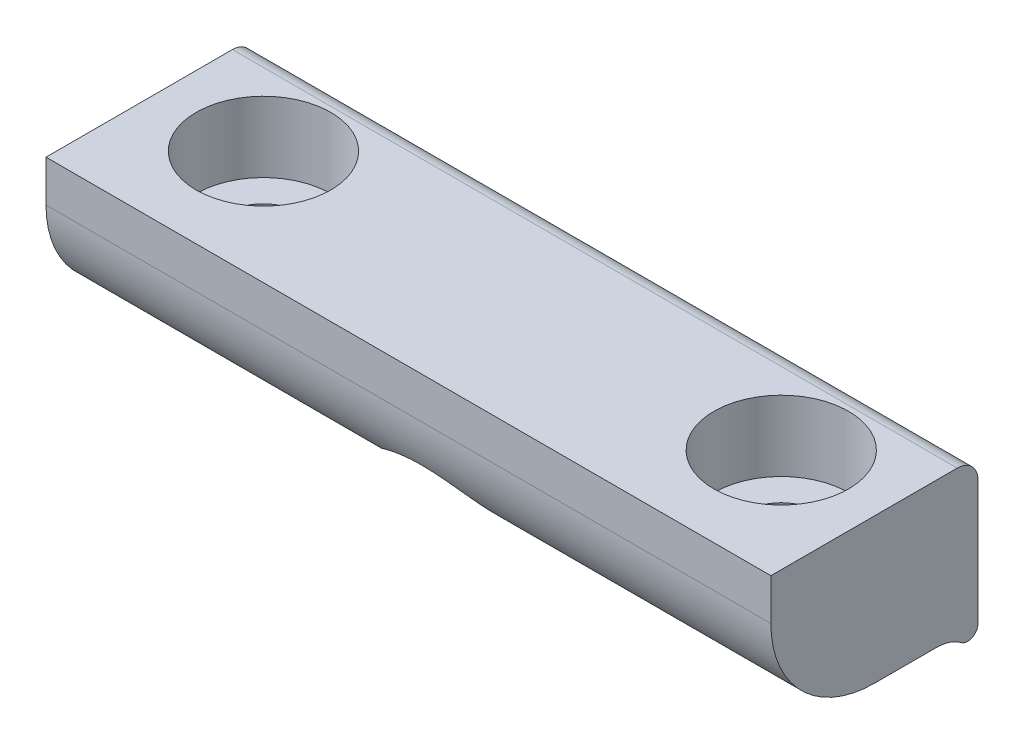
SolidWorks part; units mm, degrees
ref_plane "Спереди" through (0, 0, 0) normal (0, 0, 1) x (1, 0, 0)
ref_plane "Сверху" through (0, 0, 0) normal (0, 1, 0) x (1, 0, 0)
ref_plane "Справа" through (0, 0, 0) normal (1, 0, 0) x (0, 0, -1)
sketch "Эскиз1" plane through (0, 0, 0) normal (1, 0, 0) x (0, 0, -1)
  line L0 (0, 16.5594) -> (0, 0) construction
  line L1 (0, 0) -> (9.1089, 0) construction
  line L2 (-2, 0) -> (-5, 0)
  line L3 (-10, 5) -> (-10, 7)
  line L4 (-10, 7) -> (0, 7)
  line L5 (0, 7) -> (0, -2)
  arc A0 (-5, 0) -> (-10, 5) centre (-5, 5) cw
  arc A1 (0, -2) -> (-2, 0) centre (-2, -2) ccw
  point P9 (-10, 0)
  dimension "D3" = 5
  dimension "D4" = 2
  dimension "D1" = 10
  dimension "D2" = 7
extrude "Бобышка-Вытянуть1" add sketch "Эскиз1" against normal blind 35
fillet "Скругление2" radius 0.5 1 edges at (-17.5, -2, 0)
sketch "Эскиз2" plane through (0, 0, 0) normal (0, 0, -1) x (-1, 0, 0)
  line L0 (17.5, 7) -> (17.5, -3.4501) construction
  line L3 (35, 7) -> (0, 7) construction
  circle A0 centre (17.5, -1.5) radius 4.05
  dimension "D1" = 8.1
  dimension "D2" = 1.5
extrude "Вырез-Вытянуть1" cut sketch "Эскиз2" against normal through all
fillet "Скругление1" radius 1 1 edges at (-17.5, 7, 0)
hole_wizard "Цековка для винта с внутренним шестигранником M31" positions "Эскиз5" profile "Эскиз4" counterbore size "M3" standard "DIN"
sketch "Эскиз5" plane through (0, 7, 0) normal (0, 1, 0) x (1, 0, 0)
  line L0 (-35, -4.5) -> (0, -4.5) construction
  line L1 (-35, -1) -> (-35, -10) construction
  line L2 (0, -1) -> (0, -10) construction
  line L4 (-17.5, 0) -> (-17.5, -10) construction
  line L7 (-35, -10) -> (0, -10) construction
  point P2 (-30, -4.5)
  point P21 (-5, -4.5)
  dimension "D1" = 25
  dimension "D2" = 5.5
sketch "Эскиз4" plane through (-30, 7, 4.5) normal (1, 0, 0) x (0, 0, 1)
  line L0 (0, 0) -> (0, 7.512)
  line L1 (0, 7.512) -> (1.7, 7.512)
  line L3 (1.7, 7.512) -> (1.7, 3.4)
  line L4 (1.7, 3.4) -> (3.25, 3.4)
  line L5 (3.25, 3.4) -> (3.25, 0)
  line L7 (3.25, 0) -> (0, 0)
  line L11 (0, -6.35) -> (0, 107.95) construction
  dimension "Диаметр сквозного отверстия" = 3.4
  dimension "Глубина сквозного отверстия" = 7.512
  dimension "Диаметр цековки" = 6.5
  dimension "Глубина цековки" = 3.4
